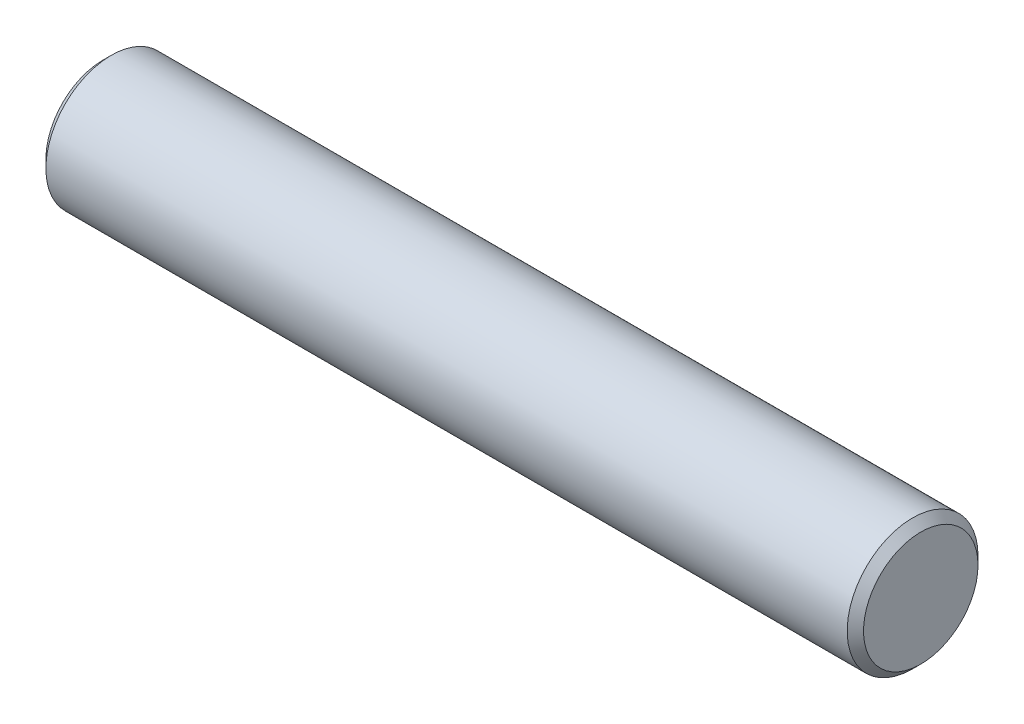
SolidWorks part; units mm, degrees
ref_plane "Face" through (0, 0, 0) normal (0, 0, 1) x (1, 0, 0)
ref_plane "Dessus" through (0, 0, 0) normal (0, 1, 0) x (1, 0, 0)
ref_plane "Droite" through (0, 0, 0) normal (1, 0, 0) x (0, 0, -1)
sketch "Esquisse1" plane through (0, 0, 0) normal (0, 0, 1) x (1, 0, 0)
  line L0 (110.4536, 0) -> (-24.4471, 0) construction
  line L1 (0, 0) -> (50, 0)
  line L2 (0, 0) -> (0, 3.5)
  line L3 (0.5, 4) -> (49.5, 4)
  line L4 (50, 0) -> (50, 3.5)
  line L5 (0, 3.5) -> (0.5, 4)
  line L6 (49.5, 4) -> (50, 3.5)
  point P1 (50, 4)
  point P2 (0, 4)
  dimension "D1" = 8
  dimension "D2" = 50
  dimension "D5" = 0.5
  dimension "D6" = 0.5
revolve "Révolution1" add sketch "Esquisse1" angle 360 about L0
